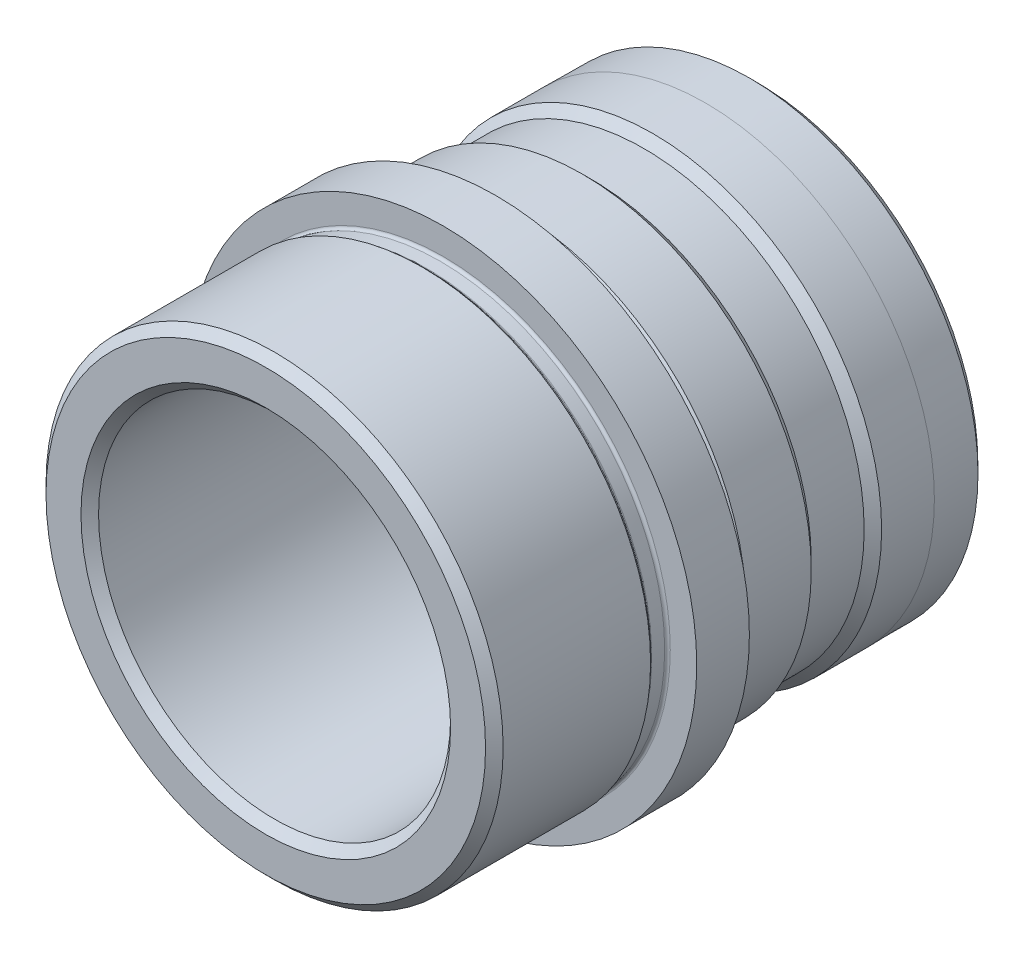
SolidWorks part; units mm, degrees
ref_plane "Front Plane" through (0, 0, 0) normal (0, 0, 1) x (1, 0, 0)
ref_plane "Top Plane" through (0, 0, 0) normal (0, 1, 0) x (1, 0, 0)
ref_plane "Right Plane" through (0, 0, 0) normal (1, 0, 0) x (0, 0, -1)
sketch "Sketch1" plane through (0, 0, 0) normal (1, 0, 0) x (0, 0, -1)
  line L0 (0, 0) -> (0, 13.8025) construction
  line L1 (0, 0) -> (-10.6147, 0) construction
  line L2 (-16.002, 15.8826) -> (28.448, 15.8826)
  line L3 (-16.002, 15.8826) -> (-16.002, 20.6248)
  line L4 (-16.002, 20.6248) -> (-1.905, 20.6248)
  line L5 (28.448, 20.6023) -> (28.448, 15.8826)
  line L6 (0, 22.8854) -> (0, 20.2438)
  line L7 (0, 22.8854) -> (4.7498, 22.8854)
  line L8 (4.7498, 22.8854) -> (4.7498, 20.2438)
  line L9 (13.3604, 19.8564) -> (18.1356, 19.8564)
  line L10 (18.923, 20.6438) -> (23.6855, 20.6438)
  line L11 (13.3604, 19.8564) -> (12.573, 20.6438)
  line L12 (18.1356, 19.8564) -> (18.923, 20.6438)
  line L13 (15.748, 19.8564) -> (15.748, 10.5708) construction
  line L14 (-1.524, 20.2438) -> (0, 20.2438)
  line L15 (6.6738, 20.6438) -> (12.573, 20.6438)
  line L16 (23.6855, 20.6438) -> (28.448, 20.6023)
  line L17 (-1.524, 20.2438) -> (-1.905, 20.6248)
  line L18 (6.2738, 20.2438) -> (6.6738, 20.6438)
  line L19 (4.7498, 20.2438) -> (6.2738, 20.2438)
  dimension "D8" = 6.35
  dimension "D1" = 41.2496
  dimension "D2" = 31.7652
  dimension "D3" = 45.7708
  dimension "D4" = 4.7498
  dimension "D5" = 28.448
  dimension "D6" = 44.45
  dimension "D7" = 0.7874
  dimension "D9" = 45
  dimension "D10" = 4.7625
  dimension "D11" = 41.2877
  dimension "D12" = 0.5
  dimension "D13" = 15.748
  dimension "D14" = 0.381
  dimension "D15" = 1.524
  dimension "D16" = 1.524
  dimension "D17" = 45
  dimension "D18" = 45
revolve "Revolve1" add sketch "Sketch1" angle 360 about L1
sketch "Sketch2" plane through (0, 0, 0) normal (0, 1, 0) x (1, 0, 0)
  line L0 (-22.8854, 0) -> (22.8854, 0) construction
  circle A0 centre (0, 15.748) radius 2.3749
  dimension "D1" = 4.7498
  dimension "D2" = 15.748
extrude "Cut-Extrude1" cut sketch "Sketch2" against normal through all
fillet "Fillet1" radius 3.048 1 edges at (-15.8826, 0, -28.448)
chamfer "Chamfer1" distance 0.7937 angle 45 3 edges at (-20.6023, 0, -28.448) (-20.6248, 0, 16.002) (-15.8826, 0, 16.002)
fillet "Fillet2" radius 0.254 4 edges at (-20.2438, 0, -6.2738) (-20.2438, 0, -4.7498) (-20.2438, 0, 1.524) (-20.2438, 0, 0)
